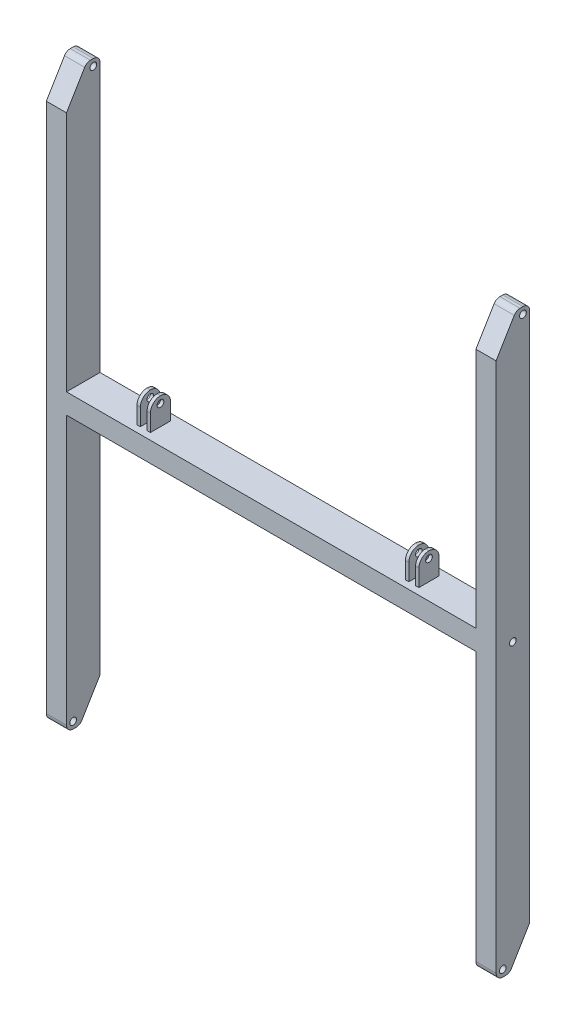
SolidWorks part; units mm, degrees
ref_plane "前视基准面" through (0, 0, 0) normal (0, 0, 1) x (1, 0, 0)
ref_plane "上视基准面" through (0, 0, 0) normal (0, 1, 0) x (1, 0, 0)
ref_plane "右视基准面" through (0, 0, 0) normal (1, 0, 0) x (0, 0, -1)
sketch "草图2" plane through (0, 0, 0) normal (0, 0, 1) x (1, 0, 0)
  line L0 (0, 0) -> (0, 153.8889) construction
  line L1 (0, 0) -> (-277.2222, 0) construction
  line L2 (-610, 30) -> (610, 30)
  line L3 (-610, 30) -> (-610, -30)
  line L4 (-610, -30) -> (610, -30)
  line L5 (610, 30) -> (610, -30)
  line L6 (-610, 30) -> (610, -30) construction
  line L7 (-610, -30) -> (610, 30) construction
  line L8 (-610, 750) -> (-670, 750)
  line L9 (-610, 750) -> (-610, -750)
  line L10 (-610, -750) -> (-670, -750)
  line L11 (-670, 750) -> (-670, -750)
  line L12 (610, -750) -> (670, -750)
  line L13 (610, 750) -> (610, -750)
  line L14 (610, 750) -> (670, 750)
  line L15 (610, 30) -> (610, -30)
  line L16 (670, 750) -> (670, -750)
  dimension "D1" = 60
  dimension "D2" = 1500
  dimension "D3" = 1340
extrude "凸台-拉伸1" add sketch "草图2" along normal mid plane 100 contours L8 L11 L10 L9 L3 | L5 L2 L3 L4 | L16 L14 L13 L5 L12
sketch "草图4" plane through (0, 30, 0) normal (0, 1, 0) x (1, 0, 0)
  line L0 (0, 0) -> (-400, 0) construction
  line L2 (-420, 30) -> (-380, 30)
  line L3 (-420, 30) -> (-420, -30)
  line L4 (-420, -30) -> (-380, -30)
  line L5 (-380, 30) -> (-380, -30)
  line L6 (-420, 30) -> (-380, -30) construction
  line L7 (-420, -30) -> (-380, 30) construction
  dimension "D1" = 40
  dimension "D2" = 60
  dimension "D3" = 400
extrude "凸台-拉伸2" add sketch "草图4" along normal blind 80
sketch "草图5" plane through (-380, 0, 0) normal (1, 0, 0) x (0, 0, -1)
  line L0 (0, 110) -> (0, 90) construction
  line L1 (-30, 110) -> (30, 110) construction
  circle A0 centre (0, 90) radius 10
  dimension "D1" = 20
  dimension "D2" = 20
extrude "切除-拉伸1" cut sketch "草图5" against normal blind 80
fillet "圆角1" radius 30 2 edges at (-400, 110, -30) (-400, 110, 30)
sketch "草图6" plane through (0, 0, 30) normal (0, 0, 1) x (1, 0, 0)
  line L0 (-400, 110) -> (-400, 13.3706) construction
  line L1 (-420, 110) -> (-380, 110) construction
  line L2 (-610, 30) -> (610, 30) construction
  line L3 (-410, 110) -> (-390, 110)
  line L4 (-410, 110) -> (-410, 30)
  line L5 (-410, 30) -> (-390, 30)
  line L6 (-390, 110) -> (-390, 30)
  line L7 (-410, 110) -> (-390, 30) construction
  line L8 (-410, 30) -> (-390, 110) construction
  point P4 (-400, 70)
  dimension "D1" = 20
extrude "切除-拉伸2" cut sketch "草图6" against normal blind 80
sketch "草图7" plane through (-610, 0, 0) normal (1, 0, 0) x (0, 0, -1)
  line L0 (-50, 750) -> (10, 850)
  line L1 (10, 850) -> (50, 850)
  line L2 (50, 850) -> (50, 750)
  line L3 (50, 750) -> (-50, 750)
  line L4 (30, 850) -> (30, 830) construction
  line L5 (-50, -750) -> (-50, -850)
  line L6 (-50, 750) -> (-50, -750) construction
  line L7 (-50, -850) -> (-10, -850)
  line L8 (-10, -850) -> (50, -750)
  line L9 (50, 750) -> (50, -750) construction
  line L10 (50, -750) -> (-50, -750)
  line L11 (-30, -850) -> (-30, -830) construction
  line L12 (-50, -750) -> (50, -750) construction
  circle A0 centre (30, 830) radius 10
  circle A1 centre (-30, -830) radius 10
  point P22 (0, -750)
  dimension "D1" = 20
  dimension "D2" = 100
  dimension "D3" = 40
  dimension "D4" = 20
extrude "凸台-拉伸3" add sketch "草图7" against normal blind 60
fillet "圆角2" radius 20 4 edges at (-640, 850, -10) (-640, 850, -50) (-640, -850, 10) (-640, -850, 50)
mirror "镜向1" about plane through (0, 0, 0) normal (1, 0, 0) of "圆角2", "凸台-拉伸3", "切除-拉伸2", "圆角1", "切除-拉伸1", "凸台-拉伸2"
sketch "草图8" plane through (0, 0, 0) normal (1, 0, 0) x (0, 0, -1)
  circle A0 centre (0, 0) radius 10
  dimension "D1" = 20
extrude "切除-拉伸3" cut sketch "草图8" against normal mid plane 1500
